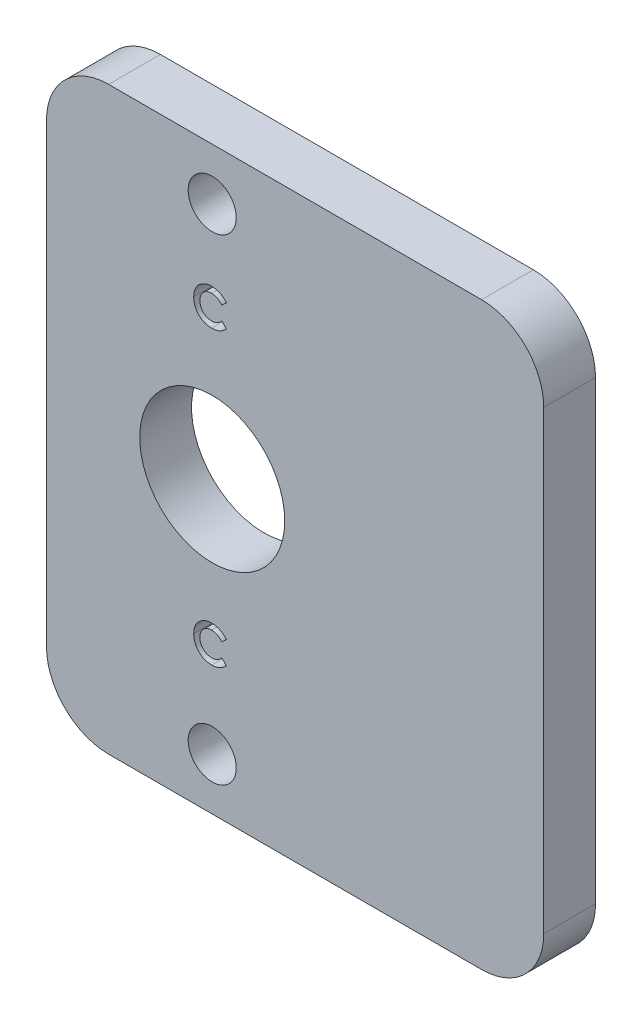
SolidWorks part; units mm, degrees
ref_plane "Front Plane" through (0, 0, 0) normal (0, 0, 1) x (1, 0, 0)
ref_plane "Top Plane" through (0, 0, 0) normal (0, 1, 0) x (1, 0, 0)
ref_plane "Right Plane" through (0, 0, 0) normal (1, 0, 0) x (0, 0, -1)
sketch "Sketch2" plane through (0, 0, 0) normal (0, 0, 1) x (1, 0, 0)
  line L1 (0, 0) -> (30.48, 0)
  line L2 (0, 0) -> (0, 35.56)
  line L3 (0, 35.56) -> (30.48, 35.56)
  line L4 (30.48, 0) -> (30.48, 35.56)
  circle A0 centre (10.16, 17.78) radius 4.445
  dimension "D3" = 8.89
  dimension "D1" = 30.48
  dimension "D2" = 35.56
  dimension "D4" = 17.78
  dimension "D5" = 10.16
extrude "Boss-Extrude1" add sketch "Sketch2" along normal blind 3.175
hole_wizard "#4 Clearance Hole1" positions "Sketch4" profile "Sketch3" hole size "#4" standard "ANSI Inch"
sketch "Sketch4" plane through (0, 0, 3.175) normal (0, 0, 1) x (1, 0, 0)
  line L5 (0, 0) -> (30.48, 0) construction
  line L6 (0, 35.56) -> (30.48, 35.56) construction
  point P0 (10.16, 3.175)
  point P2 (10.16, 32.385)
  dimension "D4" = 3.175
  dimension "D1" = 14.605
  dimension "D2" = 14.605
  dimension "D3" = 3.175
sketch "Sketch3" plane through (10.16, 3.175, 3.175) normal (1, 0, 0) x (0, -1, 0)
  line L0 (0, 0) -> (0, 3.302)
  line L1 (0, 3.302) -> (1.4732, 3.302)
  line L2 (1.4732, 3.302) -> (1.4732, 0)
  line L5 (1.4732, 0) -> (0, 0)
  line L10 (0, 3.302) -> (-1.4732, 3.302) construction
  line L11 (0, -6.35) -> (0, 107.95) construction
  dimension "Hole Dia." = 2.9464
  dimension "Hole Depth" = 3.302
  dimension "Drill Angle" = 180
fillet "Fillet1" radius 3.81 4 edges at (0, 0, 1.5875) (30.48, 0, 1.5875) (30.48, 35.56, 1.5875) (0, 35.56, 1.5875)
sketch "Sketch5" plane through (0, 0, 3.175) normal (0, 0, 1) x (1, 0, 0)
  text T0 "<b>C</b>" font "Century Gothic" height in points 8
  text T1 "<b>C</b>" font "Century Gothic" height in points 8
  dimension "D1" = 1.27
extrude "Cut-Extrude1" cut sketch "Sketch5" against normal through all
